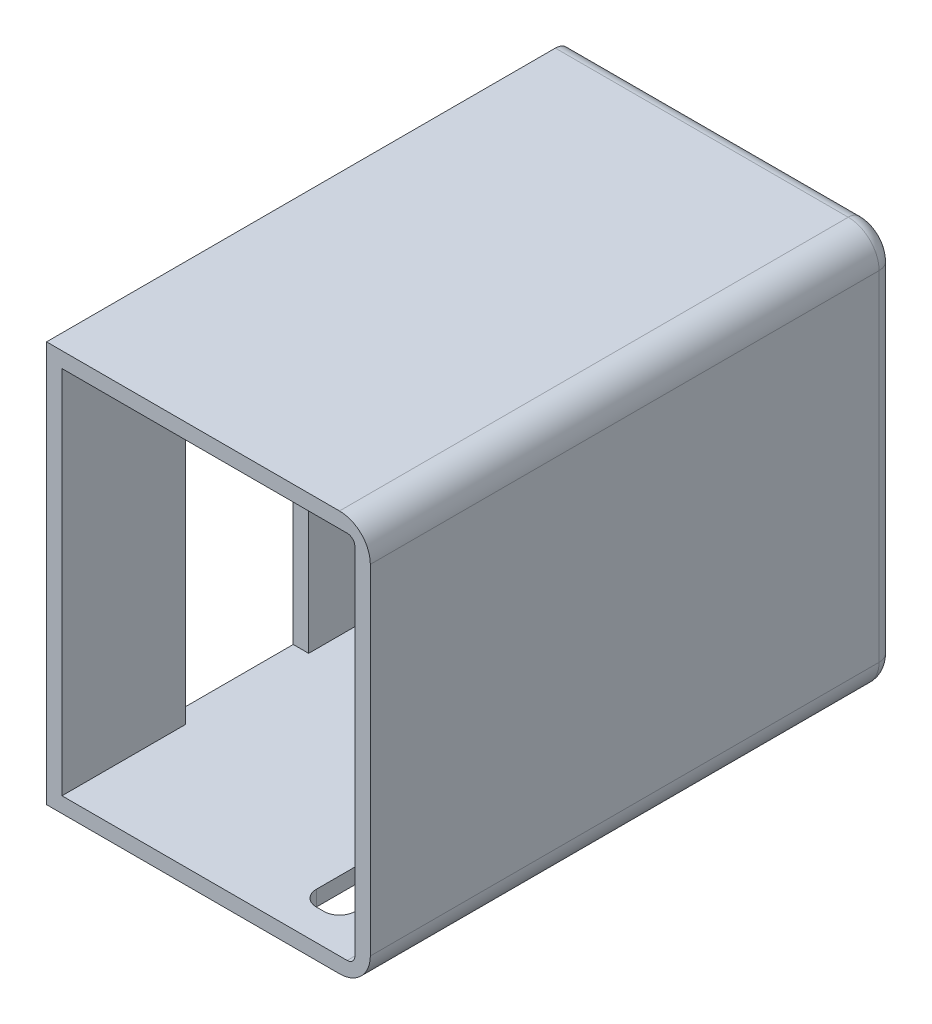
SolidWorks part; units mm, degrees
ref_plane "Alzado" through (0, 0, 0) normal (0, 0, 1) x (1, 0, 0)
ref_plane "Planta" through (0, 0, 0) normal (0, 1, 0) x (1, 0, 0)
ref_plane "Vista lateral" through (0, 0, 0) normal (1, 0, 0) x (0, 0, -1)
sketch "Croquis1" plane through (0, 0, 0) normal (0, 0, 1) x (1, 0, 0)
  line L1 (-105, 130) -> (105, 130)
  line L2 (-105, 130) -> (-105, -130)
  line L3 (-105, -130) -> (105, -130)
  line L4 (105, 130) -> (105, -130)
  line L5 (-95, 120) -> (95, 120)
  line L6 (-95, 120) -> (-95, -120)
  line L7 (-95, -120) -> (95, -120)
  line L8 (95, 120) -> (95, -120)
  line L9 (-95, 120) -> (95, -120) construction
  line L10 (-95, -120) -> (95, 120) construction
  point P0 (0, 0)
  point P6 (0, 0)
  dimension "D1" = 260
  dimension "D2" = 210
  dimension "D3" = 240
  dimension "D4" = 190
extrude "Saliente-Extruir2" add sketch "Croquis1" along normal blind 330
sketch "Croquis3" plane through (0, 0, 0) normal (0, 0, -1) x (-1, 0, 0)
  line L1 (-105, 130) -> (105, 130)
  line L2 (-105, 130) -> (-105, -130)
  line L3 (-105, -130) -> (105, -130)
  line L4 (105, 130) -> (105, -130)
  line L5 (-105, 130) -> (105, -130) construction
  line L6 (-105, -130) -> (105, 130) construction
  point P0 (0, 0)
extrude "Saliente-Extruir3" add sketch "Croquis3" along normal blind 10
sketch "Croquis4" plane through (-105, 0, 0) normal (-1, 0, 0) x (0, 0, 1)
  line L0 (330, 120) -> (-10, 120) construction
  line L1 (330, 130) -> (330, -130) construction
  line L2 (-10, -130) -> (-10, 130) construction
  line L3 (330, -120) -> (-10, -120) construction
  line L5 (330, 130) -> (-10, 130) construction
  line L6 (330, -130) -> (-10, -130) construction
  line L8 (330, 120) -> (250, 120)
  line L9 (330, 120) -> (330, -120)
  line L10 (330, -120) -> (250, -120)
  line L11 (250, 120) -> (250, -120)
  line L13 (250, 120) -> (170, 120)
  line L14 (250, 120) -> (250, -120)
  line L15 (250, -120) -> (170, -120)
  line L16 (170, 120) -> (170, -120)
  line L18 (170, 120) -> (90, 120)
  line L19 (170, 120) -> (170, -120)
  line L20 (170, -120) -> (90, -120)
  line L21 (90, 120) -> (90, -120)
  line L23 (90, 120) -> (10, 120)
  line L24 (90, 120) -> (90, -120)
  line L25 (90, -120) -> (10, -120)
  line L26 (10, 120) -> (10, -120)
  dimension "D1" = 10
  dimension "D2" = 10
  dimension "D3" = 80
  dimension "D4" = 80
  dimension "D5" = 80
  dimension "D6" = 80
extrude "Cortar-Extruir2" cut sketch "Croquis4" against normal blind 10 contours L13 L16 L15 L11 | L23 L26 L25 L21
sketch "Croquis5" plane through (0, -130, 0) normal (0, -1, 0) x (1, 0, 0)
  line L0 (105, -10) -> (-105, -10) construction
  line L1 (50, 310) -> (55, 310)
  line L2 (40, 300) -> (40, 20)
  line L3 (50, 10) -> (55, 10)
  line L4 (65, 300) -> (65, 20)
  line L5 (-105, 330) -> (105, 330) construction
  line L6 (105, 330) -> (105, -10) construction
  arc A0 (55, 10) -> (65, 20) centre (55, 20) ccw
  arc A1 (40, 20) -> (50, 10) centre (50, 20) ccw
  arc A2 (55, 310) -> (65, 300) centre (55, 300) cw
  arc A3 (50, 310) -> (40, 300) centre (50, 300) ccw
  point P12 (65, 10)
  point P15 (40, 10)
  dimension "D5" = 10
  dimension "D1" = 20
  dimension "D2" = 20
  dimension "D3" = 40
  dimension "D4" = 25
extrude "Cortar-Extruir3" cut sketch "Croquis5" against normal blind 10
fillet "Redondeo5" radius 20 1 edges at (105, -130, 160)
fillet "Redondeo6" radius 20 1 edges at (105, 130, 160)
fillet "Redondeo7" radius 5 1 edges at (95, -120, 165)
fillet "Redondeo8" radius 5 1 edges at (95, 120, 165)
fillet "Redondeo9" radius 10 5 edges at (-10, 130, -10) (99.1421, 124.1421, -10) (105, 0, -10) (99.1421, -124.1421, -10) (-10, -130, -10)
